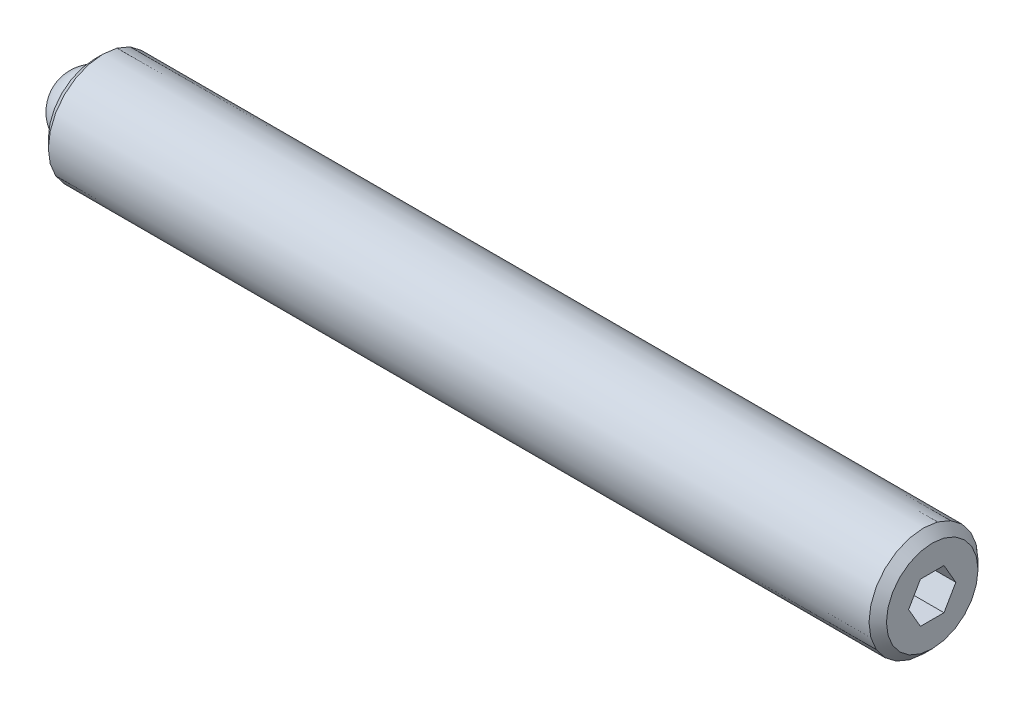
SolidWorks part; units mm, degrees
ref_plane "Front Plane" through (0, 0, 0) normal (0, 0, 1) x (1, 0, 0)
ref_plane "Top Plane" through (0, 0, 0) normal (0, 1, 0) x (1, 0, 0)
ref_plane "Right Plane" through (0, 0, 0) normal (1, 0, 0) x (0, 0, -1)
sketch "Sketch2" plane through (0, 0, 0) normal (1, 0, 0) x (0, 0, -1)
  circle A0 centre (0, 0) radius 3.175
  dimension "D1" = 6.35
extrude "Boss-Extrude1" add sketch "Sketch2" along normal blind 48.8156
sketch "Sketch3" plane through (0, 0, 0) normal (-1, 0, 0) x (0, 0, 1)
  circle A0 centre (0, 0) radius 1.9812
  dimension "D1" = 3.9624
chamfer "Chamfer1" distance 0.508 angle 45 1 edges at (0, 0, -3.175)
chamfer "Chamfer2" distance 0.508 angle 45 1 edges at (48.8156, 0, -3.175)
sketch "Sketch4" plane through (48.8156, 0, 0) normal (1, 0, 0) x (0, 0, -1)
  line L1 (1.3748, 0) -> (0.6874, 1.1906)
  line L2 (0.6874, 1.1906) -> (-0.6874, 1.1906)
  line L3 (-0.6874, 1.1906) -> (-1.3748, 0)
  line L4 (-1.3748, 0) -> (-0.6874, -1.1906)
  line L5 (-0.6874, -1.1906) -> (0.6874, -1.1906)
  line L6 (0.6874, -1.1906) -> (1.3748, 0)
  circle A0 centre (0, 0) radius 1.1906 construction
  dimension "D1" = 2.3813
extrude "Cut-Extrude2" cut sketch "Sketch4" against normal blind 2.286
extrude "Cut-Extrude3" cut sketch "Sketch3" against normal blind 1.9844
sketch "Sketch5" plane through (0, 0, 0) normal (-1, 0, 0) x (0, 0, 1)
  line L0 (0, 0) -> (0, -1.9844)
  line L1 (0, 0) -> (0, 1.9844)
  arc A0 (0, 1.9844) -> (0, -1.9844) centre (0, 0) ccw
  dimension "D1" = 1.9844
revolve "Revolve1" add sketch "Sketch5" angle 360 about L1
sketch "Sketch6" plane through (0, 0, 0) normal (-1, 0, 0) x (0, 0, 1)
  line L0 (0, 0) -> (0, 1.9812) construction
  circle A0 centre (0, 0) radius 1.9812 construction
  arc A1 (0.0635, 1.9802) -> (-0.0635, 1.9802) centre (0, 0) ccw
  arc A2 (0.0635, 1.9802) -> (-0.0635, 1.9802) centre (0, 1.9812) ccw
  dimension "D1" = 0.127
extrude "Cut-Extrude4" cut sketch "Sketch6" against normal up to surface (1.9844 mm away) contours A2 A1
